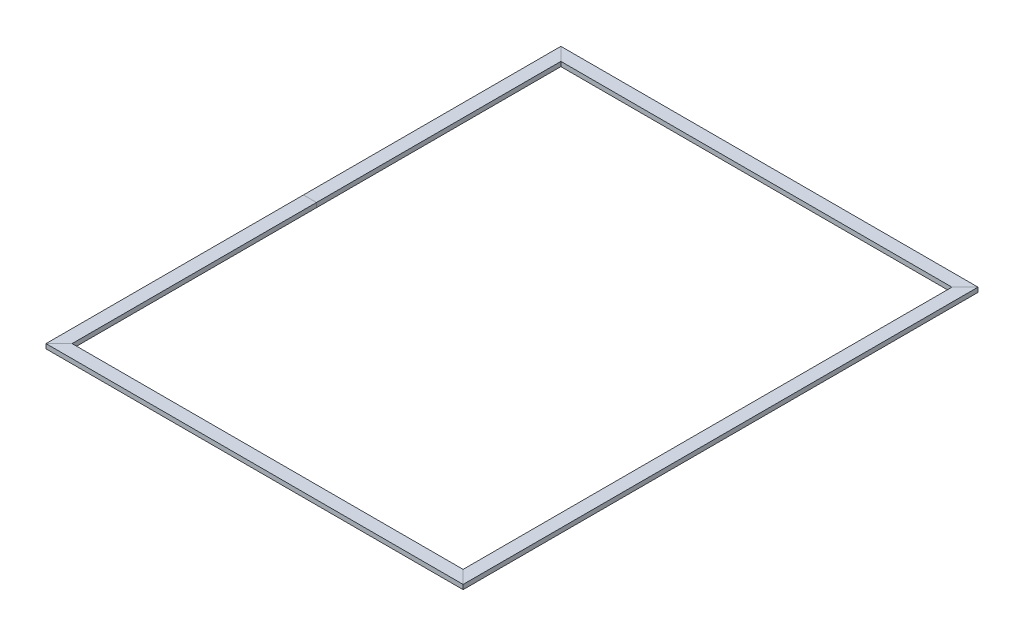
SolidWorks part; units mm, degrees
ref_plane "Front Plane" through (0, 0, 0) normal (0, 0, 1) x (1, 0, 0)
ref_plane "Top Plane" through (0, 0, 0) normal (0, 1, 0) x (1, 0, 0)
ref_plane "Right Plane" through (0, 0, 0) normal (1, 0, 0) x (0, 0, -1)
sketch "Sketch1" plane through (0, 0, 0) normal (0, 1, 0) x (1, 0, 0)
  line L1 (-620, -770) -> (620, -770)
  line L2 (-620, -770) -> (-620, 770)
  line L3 (-620, 770) -> (620, 770)
  line L4 (620, -770) -> (620, 770)
  line L5 (-620, -770) -> (620, 770) construction
  line L6 (-620, 770) -> (620, -770) construction
  point P0 (0, 0)
  dimension "D1" = 1540
  dimension "D2" = 1240
sketch "Sketch2" plane through (0, 0, 0) normal (0, 0, 1) x (1, 0, 0)
  line L1 (-640, 7) -> (-600, 7)
  line L2 (-640, 7) -> (-640, -7)
  line L3 (-640, -7) -> (-600, -7)
  line L4 (-600, 7) -> (-600, -7)
  line L5 (-640, 7) -> (-600, -7) construction
  line L6 (-640, -7) -> (-600, 7) construction
  line L7 (-620, -7) -> (-620, 0) construction
  line L8 (-620, 0) -> (620, 0) construction
  point P0 (-620, 0)
  point P7 (0, 0)
  dimension "D1" = 40
  dimension "D2" = 620
  dimension "D3" = 14
sweep "Sweep1" add profiles "Sketch2" path "Sketch1"
